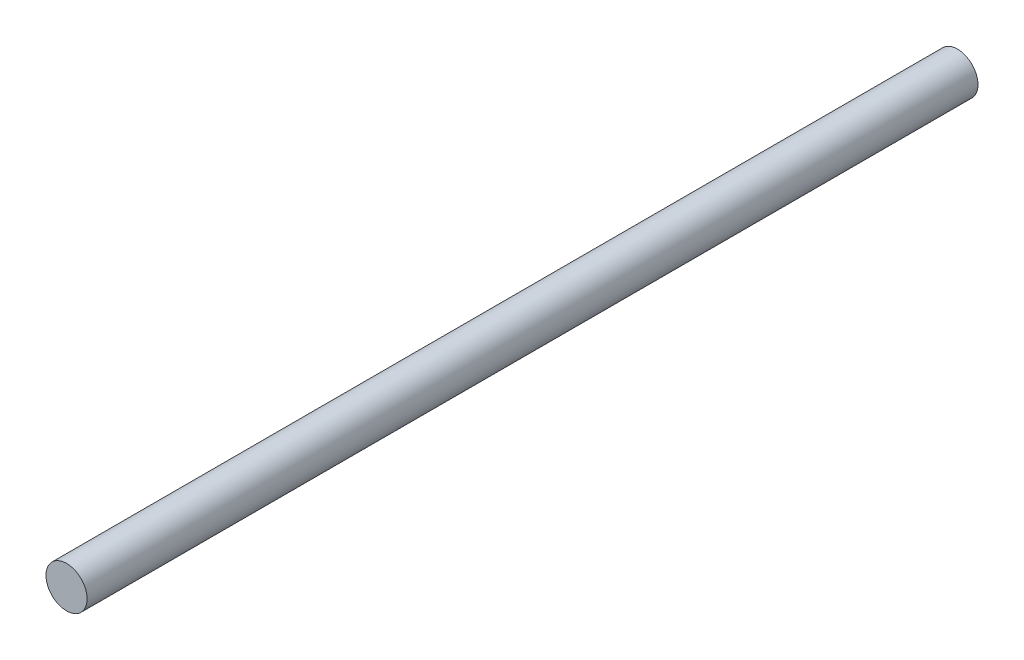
SolidWorks part; units mm, degrees
ref_plane "Front Plane" through (0, 0, 0) normal (0, 0, 1) x (1, 0, 0)
ref_plane "Top Plane" through (0, 0, 0) normal (0, 1, 0) x (1, 0, 0)
ref_plane "Right Plane" through (0, 0, 0) normal (1, 0, 0) x (0, 0, -1)
sketch "Sketch1" plane through (0, 0, 0) normal (0, 0, 1) x (1, 0, 0)
  circle A0 centre (0, 0) radius 6.35
  dimension "D1" = 12.7
extrude "Extrude1" add sketch "Sketch1" along normal mid plane 274.9017
